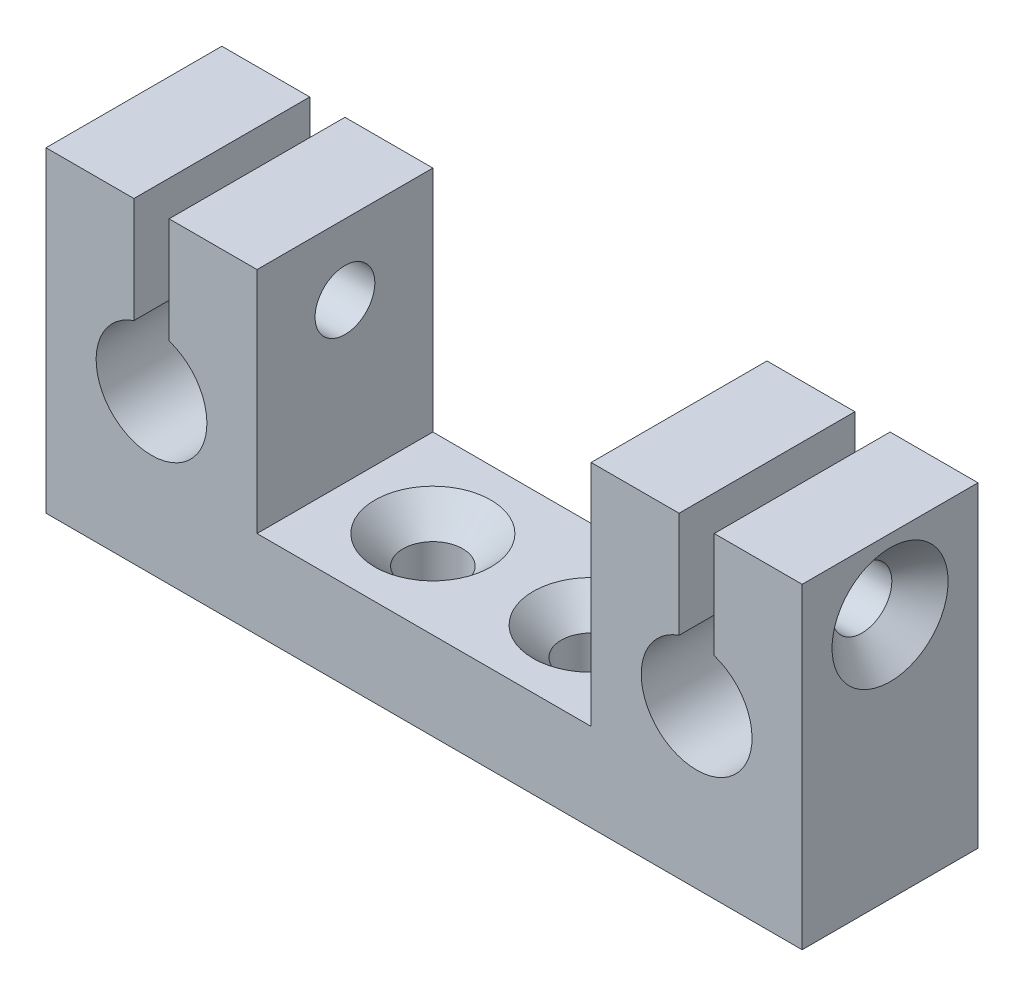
SolidWorks part; units mm, degrees
ref_plane "前视基准面" through (0, 0, 0) normal (0, 0, 1) x (1, 0, 0)
ref_plane "上视基准面" through (0, 0, 0) normal (0, 1, 0) x (1, 0, 0)
ref_plane "右视基准面" through (0, 0, 0) normal (1, 0, 0) x (0, 0, -1)
other "Configuration Table"
sketch "草图1" plane through (0, 0, 0) normal (0, 0, 1) x (1, 0, 0)
  line L0 (0, 0) -> (33.9536, 0) construction
  line L1 (0, 0) -> (0, 23.1349) construction
  line L3 (-27.5, 2.5) -> (27.5, 2.5)
  line L4 (-27.5, 2.5) -> (-27.5, -2.5)
  line L5 (-27.5, -2.5) -> (27.5, -2.5)
  line L6 (27.5, 2.5) -> (27.5, -2.5)
  line L7 (-27.5, 2.5) -> (27.5, -2.5) construction
  line L8 (-27.5, -2.5) -> (27.5, 2.5) construction
  line L9 (-21.5, 15.5) -> (-9.5, 15.5)
  line L10 (-21.5, 15.5) -> (-21.5, 2.5)
  line L11 (-21.5, 2.5) -> (-9.5, 2.5)
  line L12 (-9.5, 15.5) -> (-9.5, 2.5)
  line L13 (9.5, 15.5) -> (21.5, 15.5)
  line L14 (9.5, 15.5) -> (9.5, 2.5)
  line L15 (9.5, 2.5) -> (21.5, 2.5)
  line L16 (21.5, 15.5) -> (21.5, 2.5)
  point P1 (0, 0)
  dimension "D1" = 5
  dimension "D2" = 55
  dimension "D3" = 12
  dimension "D4" = 13
  dimension "D5" = 6
  dimension "D6" = 12
  dimension "D7" = 13
  dimension "D8" = 6
extrude "凸台-拉伸1" add sketch "草图1" along normal blind 10 contours L12 L9 L10 L3 | L6 L3 L4 L5 | L16 L13 L14 L3
sketch "草图2" plane through (0, 0, 10) normal (0, 0, 1) x (1, 0, 0)
  line L0 (-9.5, 15.5) -> (-9.5, 2.5) construction
  line L1 (9.5, 15.5) -> (9.5, 2.5) construction
  line L2 (-21.5, 15.5) -> (-9.5, 15.5) construction
  line L3 (9.5, 15.5) -> (21.5, 15.5) construction
  circle A0 centre (-15.5, 6.5) radius 3.15
  circle A1 centre (15.5, 6.5) radius 3.15
  dimension "D1" = 6.3
  dimension "D2" = 6.3
  dimension "D3" = 6
  dimension "D4" = 6
  dimension "D5" = 9
  dimension "D6" = 9
extrude "切除-拉伸1" cut sketch "草图2" against normal blind 10
sketch "草图3" plane through (0, 0, 10) normal (0, 0, 1) x (1, 0, 0)
  line L0 (-21.5, 15.5) -> (-21.5, 2.5) construction
  line L1 (-16.5, 16.9537) -> (-14.5, 16.9537)
  line L2 (-16.5, 16.9537) -> (-16.5, 7.9314)
  line L3 (-16.5, 7.9314) -> (-14.5, 7.9314)
  line L4 (-14.5, 16.9537) -> (-14.5, 7.9314)
  line L5 (14.5, 17.5112) -> (16.5, 17.5112)
  line L6 (14.5, 17.5112) -> (14.5, 7.9314)
  line L7 (14.5, 7.9314) -> (16.5, 7.9314)
  line L8 (16.5, 17.5112) -> (16.5, 7.9314)
  line L9 (9.5, 15.5) -> (9.5, 2.5) construction
  dimension "D1" = 2
  dimension "D2" = 2
  dimension "D3" = 5
  dimension "D4" = 5
extrude "切除-拉伸2" cut sketch "草图3" against normal blind 10
hole_wizard "M3 十字槽沉头木螺钉的锥形沉头孔1" positions "草图6" profile "草图7" countersink size "M3" standard "GB"
sketch "草图6" plane through (-21.5, 0, 0) normal (-1, 0, 0) x (0, 0, 1)
  line L0 (10, 15.5) -> (0, 15.5) construction
  line L1 (0, 15.5) -> (0, 2.5) construction
  point P0 (5, 11.5)
  dimension "D1" = 4
  dimension "D2" = 5
sketch "草图7" plane through (-21.5, 11.5, 5) normal (0, 1, 0) x (0, 0, 1)
  line L0 (0, 0) -> (0, 21.0215)
  line L1 (0, 21.0215) -> (1.7, 20)
  line L2 (1.7, 20) -> (1.7, 1.6)
  line L3 (1.7, 1.6) -> (3.3, 0)
  line L5 (3.3, 0) -> (0, 0)
  line L6 (-1.7, 1.6) -> (-3.3, 0) construction
  line L10 (0, 21.0215) -> (-1.7, 20) construction
  line L11 (0, -6.35) -> (0, 107.95) construction
  dimension "孔直径" = 3.4
  dimension "孔深度" = 20
  dimension "近端锥形沉头孔直径" = 6.6
  dimension "近端锥形沉头孔角度" = 90
  dimension "导头角度" = 118
hole_wizard "M3 十字槽沉头木螺钉的锥形沉头孔2" positions "草图8" profile "草图9" countersink size "M3" standard "GB"
sketch "草图8" plane through (21.5, 0, 0) normal (1, 0, 0) x (0, 0, -1)
  line L0 (-10, 15.5) -> (0, 15.5) construction
  line L1 (0, 15.5) -> (0, 2.5) construction
  point P0 (-5, 11.5)
  dimension "D1" = 4
  dimension "D2" = 5
sketch "草图9" plane through (21.5, 11.5, 5) normal (0, 1, 0) x (0, 0, -1)
  line L0 (0, 0) -> (0, 21.0215)
  line L1 (0, 21.0215) -> (1.7, 20)
  line L2 (1.7, 20) -> (1.7, 1.6)
  line L3 (1.7, 1.6) -> (3.3, 0)
  line L5 (3.3, 0) -> (0, 0)
  line L6 (-1.7, 1.6) -> (-3.3, 0) construction
  line L10 (0, 21.0215) -> (-1.7, 20) construction
  line L11 (0, -6.35) -> (0, 107.95) construction
  dimension "孔直径" = 3.4
  dimension "孔深度" = 20
  dimension "近端锥形沉头孔直径" = 6.6
  dimension "近端锥形沉头孔角度" = 90
  dimension "导头角度" = 118
hole_wizard "M3 十字槽沉头木螺钉的锥形沉头孔3" positions "草图10" profile "草图11" countersink size "M3" standard "GB"
sketch "草图10" plane through (0, 2.5, 0) normal (0, 1, 0) x (1, 0, 0)
  line L0 (-9.5, 0) -> (9.5, 0) construction
  line L1 (-9.5, -10) -> (-9.5, 0) construction
  line L2 (9.5, -10) -> (9.5, 0) construction
  point P0 (-4.5, -5)
  point P2 (4.5, -5)
  dimension "D1" = 5
  dimension "D2" = 5
  dimension "D3" = 5
  dimension "D4" = 5
sketch "草图11" plane through (-4.5, 2.5, 5) normal (1, 0, 0) x (0, 0, 1)
  line L0 (0, 0) -> (0, 12.5215)
  line L1 (0, 12.5215) -> (1.7, 11.5)
  line L2 (1.7, 11.5) -> (1.7, 1.6)
  line L3 (1.7, 1.6) -> (3.3, 0)
  line L5 (3.3, 0) -> (0, 0)
  line L6 (-1.7, 1.6) -> (-3.3, 0) construction
  line L10 (0, 12.5215) -> (-1.7, 11.5) construction
  line L11 (0, -6.35) -> (0, 107.95) construction
  dimension "孔直径" = 3.4
  dimension "孔深度" = 11.5
  dimension "近端锥形沉头孔直径" = 6.6
  dimension "近端锥形沉头孔角度" = 90
  dimension "导头角度" = 118
sketch "草图12" plane through (-27.5, 0, 0) normal (-1, 0, 0) x (0, 0, 1)
  line L4 (0, 2.5) -> (0, -2.5)
  line L5 (0, -2.5) -> (10, -2.5)
  line L6 (10, -2.5) -> (10, 2.5)
  line L7 (10, 2.5) -> (0, 2.5)
  line L8 (0, 2.5) -> (0, -2.5)
  line L9 (0, -2.5) -> (10, -2.5)
  line L10 (10, -2.5) -> (10, 2.5)
  line L11 (10, 2.5) -> (0, 2.5)
  dimension "D1" = 0
extrude "切除-拉伸3" cut sketch "草图12" against normal blind 6
sketch "草图13" plane through (27.5, 0, 0) normal (1, 0, 0) x (0, 0, -1)
  line L4 (0, -2.5) -> (0, 2.5)
  line L5 (0, 2.5) -> (-10, 2.5)
  line L6 (-10, 2.5) -> (-10, -2.5)
  line L7 (-10, -2.5) -> (0, -2.5)
  line L8 (0, -2.5) -> (0, 2.5)
  line L9 (0, 2.5) -> (-10, 2.5)
  line L10 (-10, 2.5) -> (-10, -2.5)
  line L11 (-10, -2.5) -> (0, -2.5)
  dimension "D1" = 0
extrude "切除-拉伸4" cut sketch "草图13" against normal blind 6
